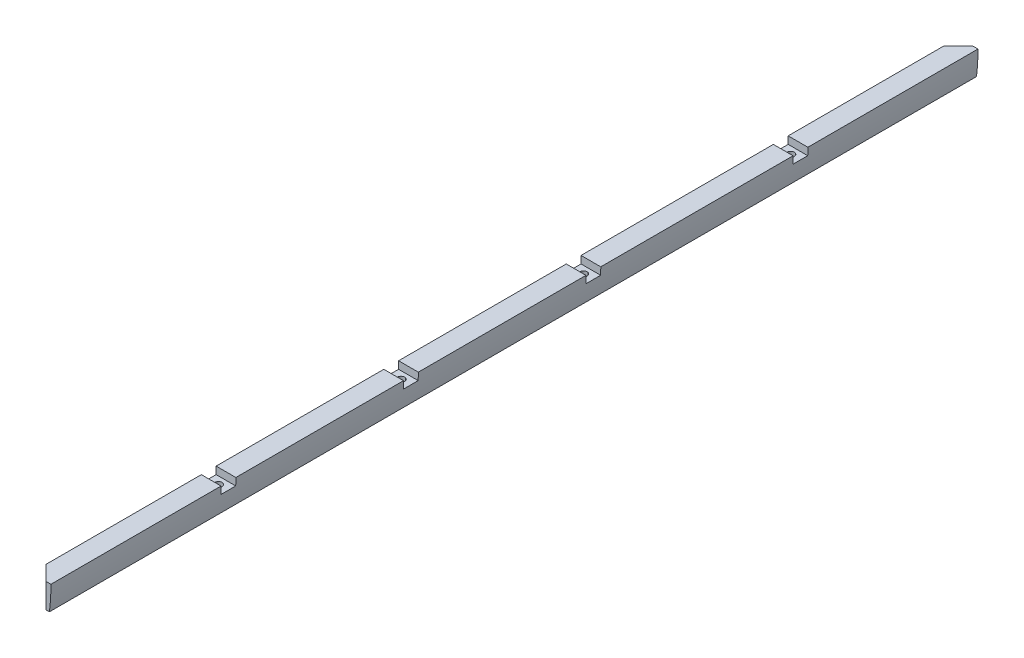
SolidWorks part; units mm, degrees
ref_plane "Plane1" through (0, 0, 0) normal (0, 0, 1) x (1, 0, 0)
ref_plane "Plane2" through (0, 0, 0) normal (0, 1, 0) x (1, 0, 0)
ref_plane "Plane3" through (0, 0, 0) normal (1, 0, 0) x (0, 0, -1)
sketch "Sketch1" plane through (0, 0, 0) normal (0, 0, 1) x (1, 0, 0)
  line L0 (234.95, 0) -> (260.35, 0)
  line L1 (234.95, 0) -> (234.95, -31.75)
  line L2 (234.95, -31.75) -> (258.4068, -31.75)
  arc A0 (258.4068, -31.75) -> (260.35, 0) centre (0, 0) ccw
  dimension "D1" = 520.7
  dimension "D2" = 31.75
  dimension "D3" = 25.4
extrude "Base-Extrude" add sketch "Sketch1" along normal blind 1193.8
sketch "Sketch2" plane through (0, 0, 0) normal (0, 1, 0) x (-1, 0, 0)
  line L0 (-260.35, 1193.8) -> (-234.95, 1193.8) construction
  line L1 (-352.3978, 219.075) -> (-155.5225, 219.075)
  line L2 (-352.3978, 219.075) -> (-352.3978, 238.125)
  line L3 (-352.3978, 238.125) -> (-155.5225, 238.125)
  line L4 (-155.5225, 219.075) -> (-155.5225, 238.125)
  line L5 (-352.3978, 485.775) -> (-155.5225, 485.775)
  line L6 (-352.3978, 485.775) -> (-352.3978, 504.825)
  line L7 (-352.3978, 504.825) -> (-155.5225, 504.825)
  line L8 (-155.5225, 485.775) -> (-155.5225, 504.825)
  line L9 (-352.3978, 720.725) -> (-155.5225, 720.725)
  line L10 (-352.3978, 720.725) -> (-352.3978, 739.775)
  line L11 (-352.3978, 739.775) -> (-155.5225, 739.775)
  line L12 (-155.5225, 720.725) -> (-155.5225, 739.775)
  line L14 (-352.3978, 974.725) -> (-155.5225, 974.725)
  line L15 (-352.3978, 974.725) -> (-352.3978, 955.675)
  line L16 (-352.3978, 955.675) -> (-155.5225, 955.675)
  line L17 (-155.5225, 974.725) -> (-155.5225, 955.675)
  line L37 (-260.35, 0) -> (-234.95, 0) construction
  dimension "D1" = 19.05
  dimension "D2" = 219.075
  dimension "D3" = 234.95
  dimension "D4" = 234.95
  dimension "D5" = 19.05
  dimension "D11" = 219.075
  dimension "D13" = 19.05
  dimension "D14" = 19.05
extrude "SlotCuts" cut sketch "Sketch2" against normal blind 9.525
sketch "Sketch3" plane through (0, 0, 0) normal (0, 1, 0) x (-1, 0, 0)
  line L0 (-254, 1193.8) -> (-234.95, 1174.75)
  line L1 (-260.35, 1193.8) -> (-234.95, 1193.8) construction
  line L2 (-234.95, 1193.8) -> (-234.95, 974.725) construction
  line L3 (-234.95, 1174.75) -> (-234.95, 1193.8)
  line L4 (-234.95, 1193.8) -> (-254, 1193.8)
  line L5 (-254, 0) -> (-234.95, 19.05)
  line L6 (-260.35, 0) -> (-234.95, 0) construction
  line L7 (-234.95, 219.075) -> (-234.95, 0) construction
  line L8 (-234.95, 19.05) -> (-234.95, 0)
  line L9 (-234.95, 0) -> (-254, 0)
  dimension "D1" = 19.05
  dimension "D2" = 19.05
  dimension "D3" = 19.05
  dimension "D4" = 19.05
extrude "RingClearance" cut sketch "Sketch3" against normal through all
sketch "Sketch4" plane through (0, -9.525, 0) normal (0, 1, 0) x (-1, 0, 0)
  line L6 (-260.35, 955.675) -> (-234.95, 955.675) construction
  line L7 (-260.1757, 974.725) -> (-260.1757, 955.675) construction
  line L8 (-260.35, 720.725) -> (-234.95, 720.725) construction
  line L9 (-260.35, 955.675) -> (-260.35, 739.775) construction
  line L10 (-234.95, 504.825) -> (-234.95, 485.775) construction
  line L11 (-260.35, 485.775) -> (-234.95, 485.775) construction
  line L12 (-234.95, 238.125) -> (-234.95, 219.075) construction
  line L13 (-260.35, 219.075) -> (-234.95, 219.075) construction
  circle A3 centre (-247.4757, 965.2) radius 4.7625
  circle A4 centre (-247.65, 730.25) radius 4.7625
  circle A5 centre (-247.65, 495.3) radius 4.7625
  circle A6 centre (-247.65, 228.6) radius 4.7625
  dimension "D10" = 9.525
  dimension "D13" = 9.525
  dimension "D16" = 9.525
  dimension "D19" = 9.525
  dimension "D11" = 9.525
  dimension "D12" = 12.7
  dimension "D14" = 9.525
  dimension "D15" = 12.7
  dimension "D17" = 12.7
  dimension "D18" = 9.525
  dimension "D20" = 12.7
  dimension "D21" = 9.525
extrude "Cut-Extrude1" cut sketch "Sketch4" against normal through all
